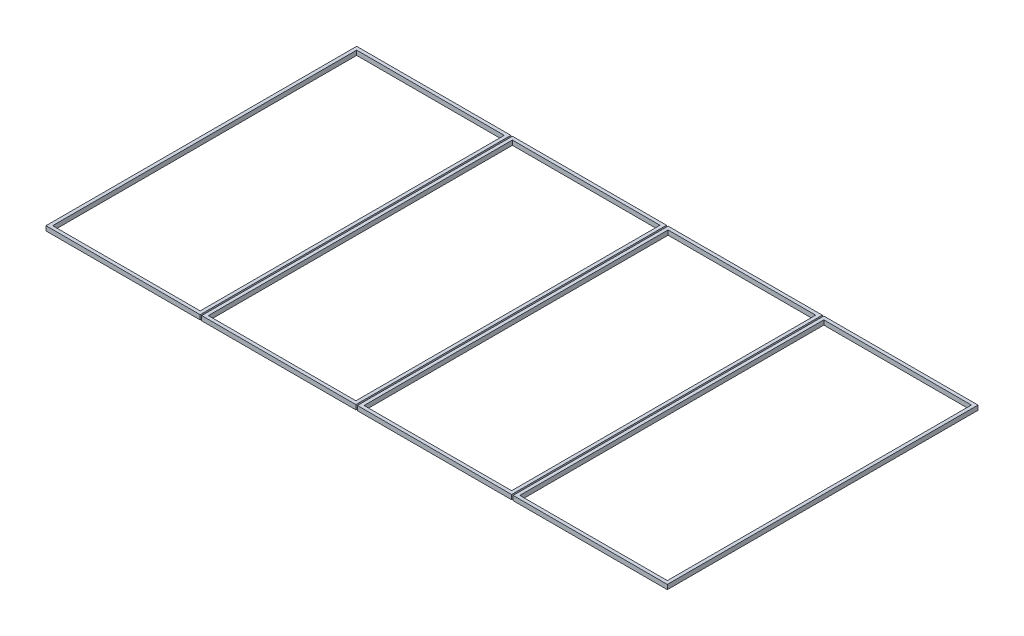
SolidWorks part; units mm, degrees
ref_plane "Front Plane" through (0, 0, 0) normal (0, 0, 1) x (1, 0, 0)
ref_plane "Top Plane" through (0, 0, 0) normal (0, 1, 0) x (1, 0, 0)
ref_plane "Right Plane" through (0, 0, 0) normal (1, 0, 0) x (0, 0, -1)
sketch "Sketch1" plane through (0, 0, 0) normal (0, 1, 0) x (1, 0, 0)
  line L2 (0, 0) -> (0, 1220)
  line L3 (0, 1220) -> (605.5, 1220)
  line L4 (2440, 0) -> (2440, 1220)
  line L5 (13, 1207) -> (592.5, 1207)
  line L10 (13, 1207) -> (13, 13)
  line L11 (13, 13) -> (592.5, 13)
  line L12 (592.5, 1207) -> (592.5, 13)
  line L13 (624.5, 1207) -> (1204, 1207)
  line L14 (624.5, 1207) -> (624.5, 13)
  line L15 (624.5, 13) -> (1204, 13)
  line L16 (1204, 1207) -> (1204, 13)
  line L17 (0, 0) -> (13, 0)
  line L18 (13, 0) -> (592.5, 0)
  line L19 (592.5, 0) -> (605.5, 0)
  line L20 (624.5, 0) -> (1204, 0)
  line L21 (1236, 13) -> (1815.5, 13)
  line L22 (1236, 13) -> (1236, 1207)
  line L23 (1236, 1207) -> (1815.5, 1207)
  line L24 (1815.5, 13) -> (1815.5, 1207)
  line L25 (605.5, 0) -> (611.5, 0) construction
  line L26 (1236, 0) -> (1815.5, 0)
  line L27 (611.5, 0) -> (624.5, 0)
  line L28 (1847.5, 0) -> (2427, 0)
  line L29 (2427, 0) -> (2440, 0)
  line L31 (1847.5, 1207) -> (2427, 1207)
  line L32 (1847.5, 1207) -> (1847.5, 13)
  line L33 (1847.5, 13) -> (2427, 13)
  line L34 (2427, 1207) -> (2427, 13)
  line L48 (1204, 0) -> (1217, 0)
  line L49 (1217, 0) -> (1223, 0) construction
  line L50 (1223, 0) -> (1236, 0)
  line L51 (1815.5, 0) -> (1828.5, 0)
  line L52 (1828.5, 0) -> (1834.5, 0) construction
  line L53 (1834.5, 0) -> (1847.5, 0)
  line L54 (605.5, 0) -> (605.5, 1220)
  line L55 (611.5, 0) -> (611.5, 1220)
  line L56 (1217, 0) -> (1217, 1220)
  line L57 (1223, 0) -> (1223, 1220)
  line L58 (1828.5, 0) -> (1828.5, 1220)
  line L59 (1834.5, 0) -> (1834.5, 1220)
  line L60 (611.5, 1220) -> (1217, 1220)
  line L61 (605.5, 1220) -> (611.5, 1220) construction
  line L62 (1223, 1220) -> (1828.5, 1220)
  line L63 (1217, 1220) -> (1223, 1220) construction
  line L64 (1834.5, 1220) -> (2440, 1220)
  line L65 (1828.5, 1220) -> (1834.5, 1220) construction
  line L66 (19.5, 1200.5) -> (586, 1200.5) construction
  line L67 (586, 1200.5) -> (586, 19.5) construction
  line L68 (19.5, 19.5) -> (586, 19.5) construction
  line L69 (19.5, 1200.5) -> (19.5, 19.5) construction
extrude "Boss.-Extru.1" add sketch "Sketch1" along normal blind 18
equation "\"D12@Sketch1\"=\"tool_diameter\""
equation "\"tool_diameter\"=6"
equation "\"material_thickness\"=18"
equation "\"clearance_tight\"=0.1"
equation "\"D1@Boss.-Extru.1\"=\"material_thickness\""
equation "\"big_holes\"=56"
equation "\"tab_thickness\" = 25"
equation "\"tab_height\" = 3"
equation "\"D6@Sketch1\"=\"tool_diameter\" + \"clearance_loose\""
equation "\"D5@Extrude-Thin1\"=\"tab_thickness\""
equation "\"D1@Extrude-Thin1\"=\"tab_height\""
equation "\"clearance_loose\"=0.5"
equation "\"small_holes\"=10"
equation "\"string\"= 2 * \"tool_diameter\" / 2 * cos ( 45deg )"
equation "\"angle\"= IIF ( \"string\" < \"limit\" , 45 , ( 180 - 2 * arcsin ( \"ThicknessVStool_dia\" ) ) / 2 )"
equation "\"limit\"= \"material_thickness\" / 2 * 9 / 10"
equation "\"ThicknessVStool_dia\"= IIF ( \"limit\" / \"tool_diameter\" > 1 , 1 , \"limit\" / \"tool_diameter\" )"
